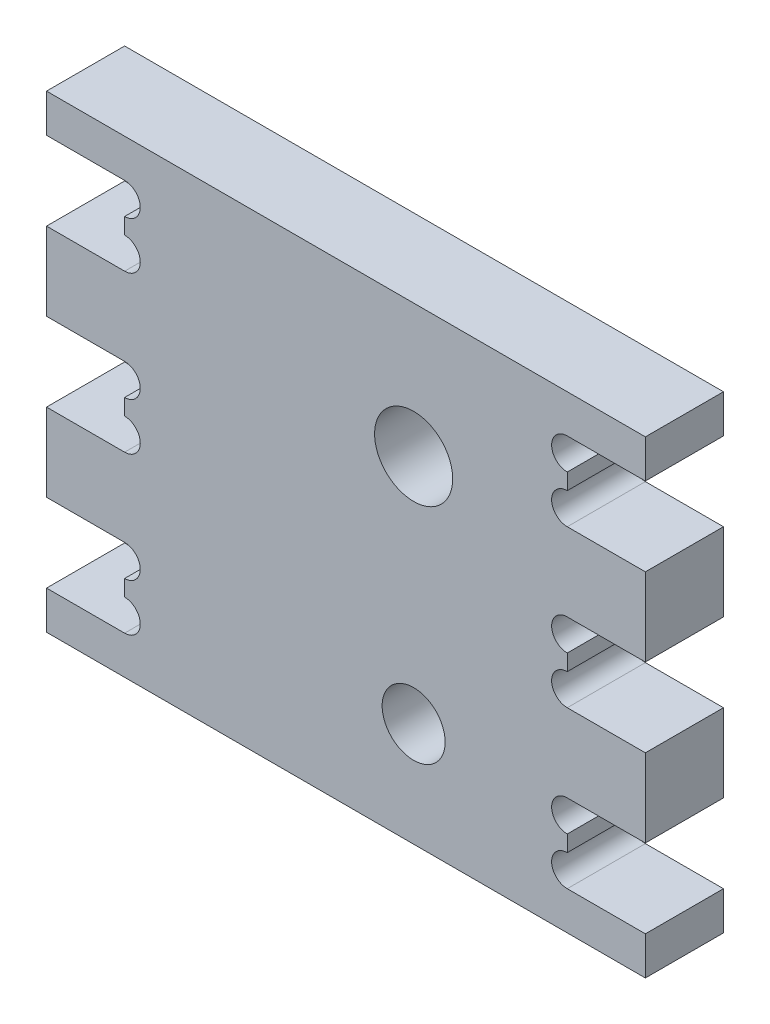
SolidWorks part; units mm, degrees
ref_plane "Ebene vorne" through (0, 0, 0) normal (0, 0, 1) x (1, 0, 0)
ref_plane "Ebene oben" through (0, 0, 0) normal (0, 1, 0) x (1, 0, 0)
ref_plane "Ebene rechts" through (0, 0, 0) normal (1, 0, 0) x (0, 0, -1)
sketch "Skizze1" plane through (0, 0, 0) normal (0, 0, 1) x (1, 0, 0)
  line L0 (15, 82.65) -> (0, 82.65)
  line L1 (0, 0) -> (115, 0)
  line L2 (15, 7.35) -> (0, 7.35)
  line L3 (0, 90) -> (115, 90)
  line L5 (0, 82.65) -> (0, 90)
  line L6 (15, 76.65) -> (15, 73.55)
  line L7 (15, 67.55) -> (0, 67.55)
  line L8 (0, 67.55) -> (0, 52.55)
  line L9 (0, 52.55) -> (15, 52.55)
  line L10 (15, 46.55) -> (15, 43.45)
  line L11 (15, 37.45) -> (0, 37.45)
  line L12 (0, 37.45) -> (0, 22.45)
  line L13 (0, 22.45) -> (15, 22.45)
  line L14 (15, 16.45) -> (15, 13.35)
  line L15 (0, 7.35) -> (0, 0)
  line L16 (115, 90) -> (115, 82.65)
  line L17 (115, 82.65) -> (100, 82.65)
  line L18 (100, 76.65) -> (100, 73.55)
  line L19 (100, 67.55) -> (115, 67.55)
  line L20 (115, 67.55) -> (115, 52.55)
  line L21 (115, 52.55) -> (100, 52.55)
  line L22 (100, 46.55) -> (100, 43.45)
  line L23 (100, 37.45) -> (115, 37.45)
  line L24 (115, 37.45) -> (115, 22.45)
  line L25 (115, 22.45) -> (100, 22.45)
  line L26 (100, 16.45) -> (100, 13.35)
  line L27 (100, 7.35) -> (115, 7.35)
  line L28 (115, 7.35) -> (115, 0)
  arc A0 (15, 76.65) -> (15, 82.65) centre (15, 79.65) ccw
  arc A1 (15, 73.55) -> (15, 67.55) centre (15, 70.55) cw
  arc A2 (15, 52.55) -> (15, 46.55) centre (15, 49.55) cw
  arc A3 (15, 37.45) -> (15, 43.45) centre (15, 40.45) ccw
  arc A4 (15, 16.45) -> (15, 22.45) centre (15, 19.45) ccw
  arc A5 (15, 13.35) -> (15, 7.35) centre (15, 10.35) cw
  arc A6 (100, 7.35) -> (100, 13.35) centre (100, 10.35) cw
  arc A7 (100, 16.45) -> (100, 22.45) centre (100, 19.45) cw
  arc A8 (100, 37.45) -> (100, 43.45) centre (100, 40.45) cw
  arc A9 (100, 46.55) -> (100, 52.55) centre (100, 49.55) cw
  arc A10 (100, 67.55) -> (100, 73.55) centre (100, 70.55) cw
  arc A11 (100, 76.65) -> (100, 82.65) centre (100, 79.65) cw
  dimension "D13" = 15.1
  dimension "D14" = 15.1
  dimension "D15" = 15
  dimension "D16" = 15.1
  dimension "D17" = 15
  dimension "D18" = 15.1
  dimension "D1" = 115
  dimension "D2" = 90
  dimension "D3" = 7.35
  dimension "D4" = 7.35
  dimension "D5" = 15
  dimension "D6" = 15
  dimension "D7" = 6
  dimension "D8" = 6
  dimension "D9" = 15.1
  dimension "D10" = 15
  dimension "D11" = 15.1
  dimension "D12" = 15
  dimension "D19" = 3.1
  dimension "D20" = 3.1
  dimension "D21" = 3.1
  dimension "D22" = 3.1
  dimension "D23" = 3.1
  dimension "D24" = 15
  dimension "D25" = 6
  dimension "D26" = 6
  dimension "D27" = 6
  dimension "D28" = 6
  dimension "D29" = 6
extrude "outline" add sketch "Skizze1" along normal blind 15
sketch "Skizze2" plane through (0, 0, 15) normal (0, 0, 1) x (1, 0, 0)
  line L1 (0, 90) -> (115, 90) construction
  line L3 (115, 7.35) -> (115, 0) construction
  circle A31 centre (70.5, 64.5) radius 7.5
  circle A32 centre (70.5, 20) radius 6.05
  dimension "D38" = 15
  dimension "D39" = 12.1
  dimension "D1" = 44.5
  dimension "D2" = 44.5
  dimension "D5" = 25.5
extrude "inner" cut sketch "Skizze2" against normal blind 15
